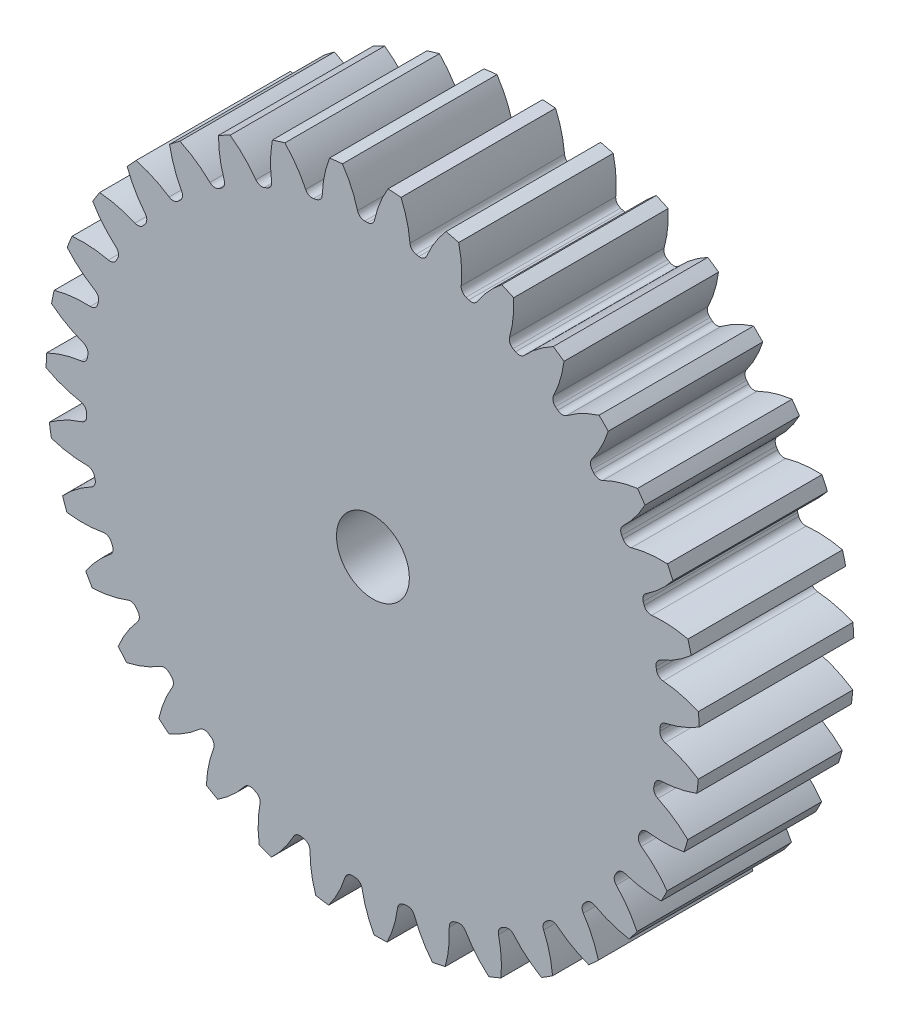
SolidWorks part; units mm, degrees
ref_plane "Front" through (0, 0, 0) normal (0, 0, 1) x (1, 0, 0)
ref_plane "Top" through (0, 0, 0) normal (0, 1, 0) x (1, 0, 0)
ref_plane "Right" through (0, 0, 0) normal (1, 0, 0) x (0, 0, -1)
sketch "Sketch3" plane through (0, 0, 0) normal (0, 0, 1) x (1, 0, 0)
  circle A0 centre (0, 0) radius 187.96
  dimension "od" = 375.92
extrude "gearBody" add sketch "Sketch3" along normal blind 88.9
sketch "Sketch2" plane through (0, 0, 0) normal (0, 0, 1) x (1, 0, 0)
  line L0 (0, 0) -> (154.3593, 63.9377) construction
  line L1 (187.3955, -17.2442) -> (0, 0) construction
  line L2 (0, 0) -> (36.3143, 0) construction
  line L3 (177.7513, 4.1627) -> (177.4126, -11.7311) construction
  line L5 (177.5819, -3.7842) -> (0, 0) construction
  line L7 (0, 0) -> (167.0773, 0) construction
  arc A0 (167.0742, 1.0205) -> (166.8791, -8.137) centre (0, 0) ccw construction
  arc A1 (187.7391, 9.1104) -> (187.1805, -17.0998) centre (0, 0) ccw construction
  arc A2 (177.7513, 4.1627) -> (177.4126, -11.7311) centre (0, 0) ccw construction
  arc A3 (165.0427, -4.3496) -> (165.0782, -2.6852) centre (0, 0) ccw
  arc A4 (187.3955, -17.2442) -> (168.1063, -8.4528) centre (151.4955, -70.4554) ccw
  arc A5 (187.3955, -17.2442) -> (187.96, 9.2455) centre (0, 0) ccw
  arc A6 (187.96, 9.2455) -> (168.3138, 1.2838) centre (154.3593, 63.9377) cw
  arc A7 (165.0782, -2.6852) -> (168.3138, 1.2838) centre (169.2127, -2.7524) cw
  arc A8 (168.1063, -8.4528) -> (165.0427, -4.3496) centre (169.1764, -4.4585) cw
  point P6 (187.96, 9.2455)
  point P22 (187.3955, -17.2442)
  dimension "baseDia" = 334.1547
  dimension "od" = 375.92
  dimension "pd" = 355.6
  dimension "rd" = 330.2
  dimension "rFillet" = 4.1351
  dimension "pointX" = 187.96
  dimension "pointY" = 9.2455
  dimension "CTT" = 15.8937
  dimension "flankCenterAngle" = 22.5
extrude "toothCut" cut sketch "Sketch2" along normal through all
pattern_circular "CirPattern1" count 35 over 360 about axis through (0, 0, 0) along (0, 0, 1) of "toothCut"
sketch "hub1Dia" plane through (0, 0, 0) normal (0, 0, -1) x (-1, 0, 0)
  circle A0 centre (0, 0) radius 12.7
  dimension "hub1Dia" = 25.4
sketch "hub2Dia" plane through (0, 0, 88.9) normal (0, 0, 1) x (1, 0, 0)
  circle A0 centre (0, 0) radius 12.7
  dimension "hub2dia" = 25.4
sketch "boreDia" plane through (0, 0, 0) normal (0, 0, 1) x (1, 0, 0)
  circle A0 centre (0, 0) radius 20.955
  dimension "boreDia" = 41.91
extrude "bore" cut sketch "boreDia" against normal mid plane 25400
